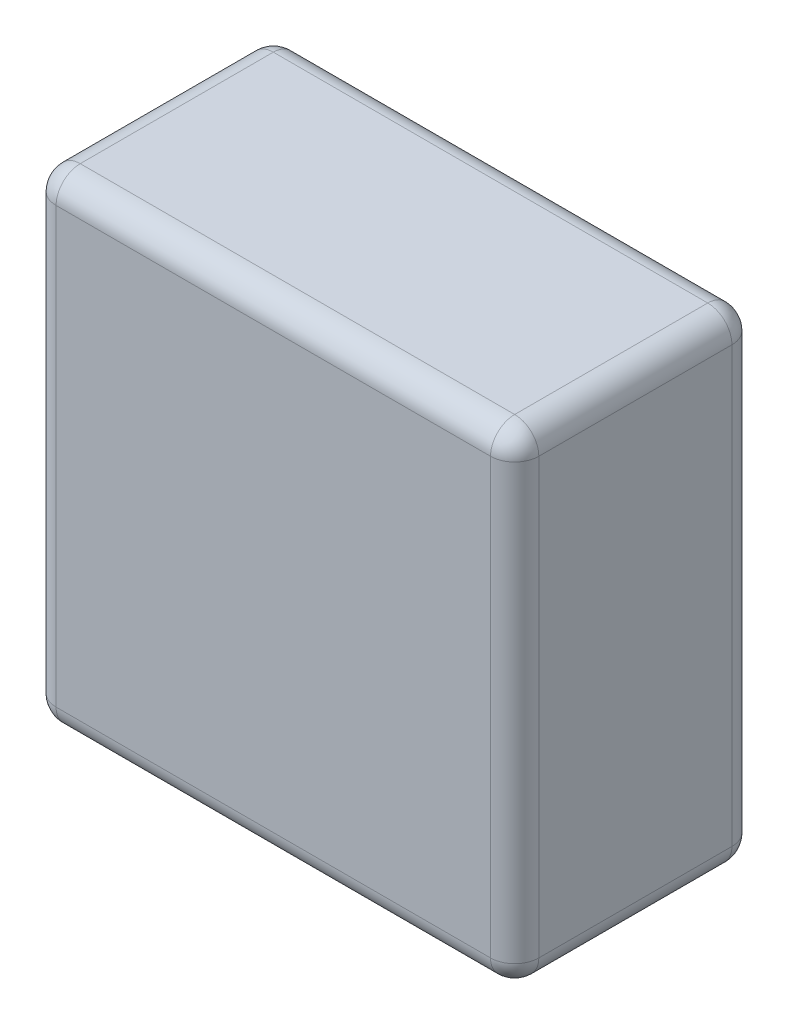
SolidWorks part; units mm, degrees
ref_plane "Front Plane" through (0, 0, 0) normal (0, 0, 1) x (1, 0, 0)
ref_plane "Top Plane" through (0, 0, 0) normal (0, 1, 0) x (1, 0, 0)
ref_plane "Right Plane" through (0, 0, 0) normal (1, 0, 0) x (0, 0, -1)
sketch "Sketch1" plane through (0, 0, 0) normal (0, 0, 1) x (1, 0, 0)
  line L1 (-326.4, 109.6) -> (-126.4, 109.6)
  line L2 (-326.4, 109.6) -> (-326.4, -90.4)
  line L3 (-326.4, -90.4) -> (-126.4, -90.4)
  line L4 (-126.4, 109.6) -> (-126.4, -90.4)
  dimension "D1" = 200
  dimension "D2" = 200
extrude "Boss-Extrude1" add sketch "Sketch1" along normal blind 100
fillet "Fillet1" radius 10 12 edges at (-226.4, -90.4, 0) (-326.4, -90.4, 50) (-326.4, 9.6, 0) (-226.4, -90.4, 100) (-326.4, 9.6, 100) (-126.4, -90.4, 50) (-126.4, 9.6, 100) (-126.4, 9.6, 0) (-126.4, 109.6, 50) (-226.4, 109.6, 100) (-326.4, 109.6, 50) (-226.4, 109.6, 0)
